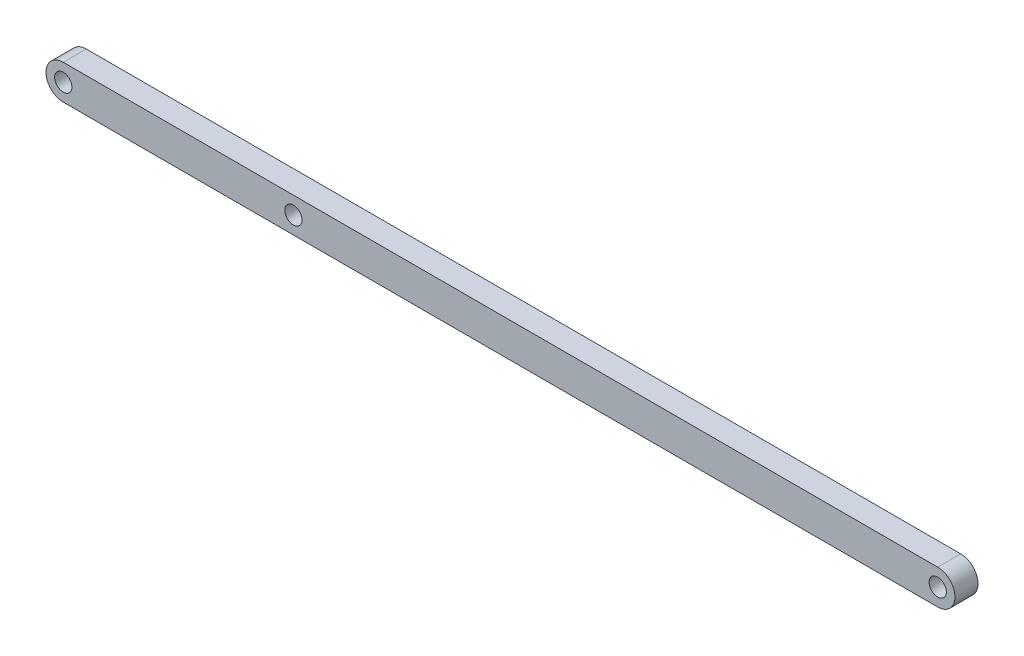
SolidWorks part; units mm, degrees
ref_plane "Plan1" through (0, 0, 0) normal (0, 0, 1) x (1, 0, 0)
ref_plane "Plan2" through (0, 0, 0) normal (0, 1, 0) x (1, 0, 0)
ref_plane "Plan3" through (0, 0, 0) normal (1, 0, 0) x (0, 0, -1)
sketch "Esquisse1" plane through (0, 0, 0) normal (0, 0, 1) x (1, 0, 0)
  line L0 (0, 1.5) -> (76, 1.5)
  line L1 (0, -1.5) -> (76, -1.5)
  arc A0 (0, 1.5) -> (0, -1.5) centre (0, 0) ccw
  arc A1 (76, -1.5) -> (76, 1.5) centre (76, 0) ccw
  circle A2 centre (0, 0) radius 0.75
  circle A3 centre (76, 0) radius 0.75
  dimension "D1" = 1.5
  dimension "D2" = 76
  dimension "D3" = 1.5
  dimension "D4" = 1.5
  dimension "D5" = 1.5
extrude "Base-Extrusion" add sketch "Esquisse1" along normal blind 2
sketch "Esquisse2" plane through (0, 0, 2) normal (0, 0, 1) x (1, 0, 0)
  circle A0 centre (20, 0) radius 0.75
  circle A1 centre (0, 0) radius 0.75 construction
  dimension "D1" = 1.5
  dimension "D2" = 20
extrude "Enlèv. mat.-Extru.1" cut sketch "Esquisse2" against normal through all
